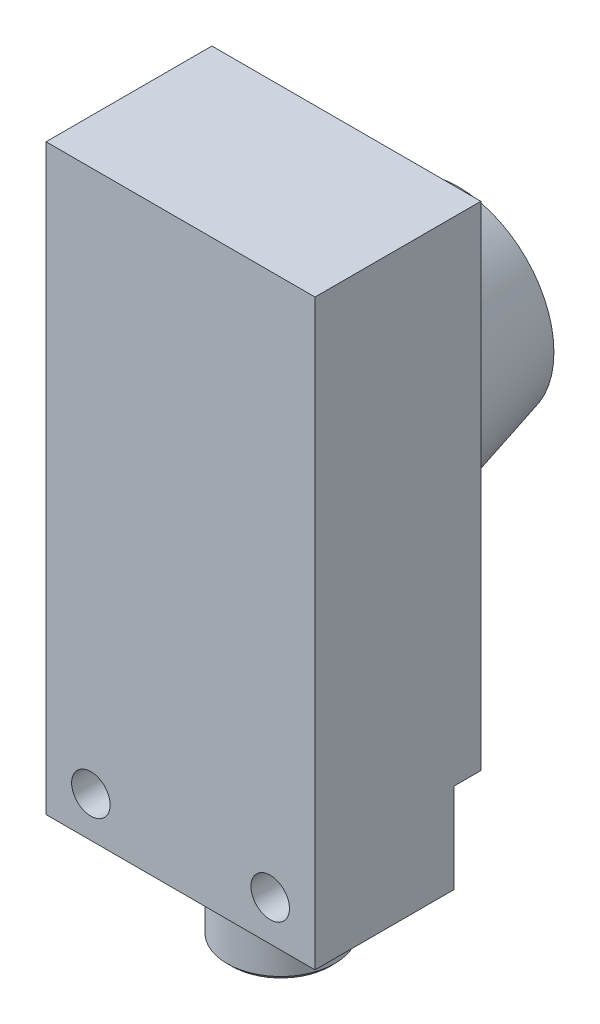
SolidWorks part; units mm, degrees
ref_plane "Face" through (0, 0, 0) normal (0, 0, 1) x (1, 0, 0)
ref_plane "Dessus" through (0, 0, 0) normal (0, 1, 0) x (1, 0, 0)
ref_plane "Droite" through (0, 0, 0) normal (1, 0, 0) x (0, 0, -1)
sketch "Esquisse1" plane through (0, 0, 0) normal (0, 0, 1) x (1, 0, 0)
  line L0 (0, 23) -> (0, 19.0553) construction
  line L1 (-15, 23) -> (15, 23)
  line L2 (-15, 23) -> (-15, -42)
  line L3 (-15, -42) -> (15, -42)
  line L4 (15, 23) -> (15, -42)
  dimension "D1" = 23
  dimension "D2" = 30
  dimension "D3" = 65
extrude "Extrusion1" add sketch "Esquisse1" along normal blind 18.5
sketch "Esquisse2" plane through (0, 0, 0) normal (1, 0, 0) x (0, 0, -1)
  line L0 (0, 14) -> (12.5, 10.6506)
  line L1 (0, -42) -> (0, 23) construction
  line L2 (12.5, 10.6506) -> (12.5, 0)
  line L3 (12.5, 0) -> (0, 0)
  line L4 (0, 0) -> (0, 14)
  line L5 (-18.5, -42) -> (-18.5, 23) construction
  line L6 (0, 0) -> (22.1796, 0) construction
  dimension "D1" = 31
  dimension "D2" = 28
  dimension "D3" = 15
revolve "Révolution1" add sketch "Esquisse2" angle 360 about L6
sketch "Esquisse3" plane through (0, 0, -12.5) normal (0, 0, -1) x (-1, 0, 0)
  circle A0 centre (0, 0) radius 4
  dimension "D1" = 8
extrude "Enlèv. mat.-Extru.1" cut sketch "Esquisse3" against normal blind 0.1
sketch "Esquisse4" plane through (0, 0, 0) normal (0, 0, -1) x (-1, 0, 0)
  line L1 (-15, -42) -> (-5, -42)
  line L2 (-15, -42) -> (-15, -32)
  line L3 (-15, -32) -> (-5, -32)
  line L4 (-5, -42) -> (-5, -32)
  line L5 (15, -42) -> (5, -42)
  line L6 (15, -42) -> (15, -32)
  line L7 (15, -32) -> (5, -32)
  line L8 (5, -42) -> (5, -32)
  dimension "D1" = 10
  dimension "D2" = 10
  dimension "D3" = 10
extrude "Enlèv. mat.-Extru.2" cut sketch "Esquisse4" against normal blind 3
sketch "Esquisse5" plane through (0, 0, 3) normal (0, 0, -1) x (-1, 0, 0)
  line L0 (-15, -42) -> (-5, -42) construction
  circle A0 centre (-10, -37.5) radius 2.15
  circle A2 centre (10, -37.5) radius 2.15
  dimension "D4" = 4.3
  dimension "D1" = 20
  dimension "D2" = 10
  dimension "D3" = 4.5
extrude "Enlèv. mat.-Extru.3" cut sketch "Esquisse5" against normal blind 20
sketch "Esquisse6" plane through (0, -42, 0) normal (0, -1, 0) x (1, 0, 0)
  line L1 (-15, 18.5) -> (15, 18.5) construction
  circle A0 centre (0, 7.3) radius 6
  dimension "D1" = 12
  dimension "D2" = 11.2
extrude "Extrusion2" add sketch "Esquisse6" along normal blind 10
chamfer "Chanfrein1" distance 0.5 angle 45 1 edges at (6, -52, 7.3)
